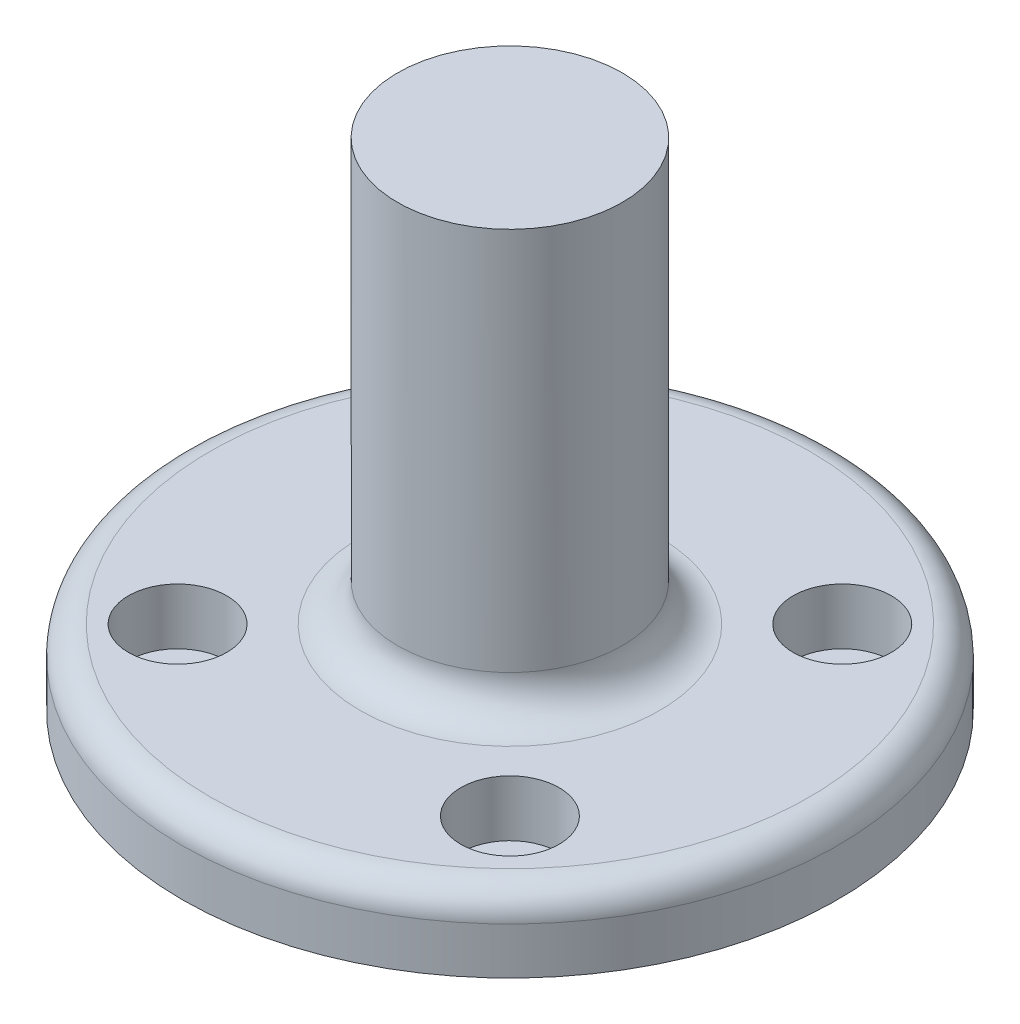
SolidWorks part; units mm, degrees
ref_plane "Front Plane" through (0, 0, 0) normal (0, 0, 1) x (1, 0, 0)
ref_plane "Top Plane" through (0, 0, 0) normal (0, 1, 0) x (1, 0, 0)
ref_plane "Right Plane" through (0, 0, 0) normal (1, 0, 0) x (0, 0, -1)
sketch "Sketch1" plane through (0, 0, 0) normal (0, 1, 0) x (1, 0, 0)
  circle A0 centre (0, 0) radius 35
  dimension "D1" = 70
extrude "Boss-Extrude1" add sketch "Sketch1" along normal blind 8
sketch "Sketch2" plane through (0, 8, 0) normal (0, 1, 0) x (1, 0, 0)
  circle A0 centre (-17.75, 17.75) radius 5.25
  circle A1 centre (17.75, 17.75) radius 5.25
  circle A2 centre (17.75, -17.75) radius 5.25
  circle A3 centre (-17.75, -17.75) radius 5.25
extrude "Cut-Extrude1" cut sketch "Sketch2" against normal blind 6
sketch "Sketch3" plane through (0, 2, 0) normal (0, 1, 0) x (1, 0, 0)
  circle A0 centre (17.75, 17.75) radius 3.25
  circle A1 centre (-17.75, 17.75) radius 3.25
  circle A2 centre (-17.75, -17.75) radius 3.25
  circle A3 centre (17.75, -17.75) radius 3.25
  dimension "D1" = 6.5
extrude "Cut-Extrude2" cut sketch "Sketch3" against normal blind 2
sketch "Sketch4" plane through (0, 0, 0) normal (0, 0, 1) x (1, 0, 0)
  line L0 (0, 43) -> (0, 53)
  line L1 (35, 8) -> (-35, 8) construction
  line L2 (0, 43) -> (0, 8)
  line L3 (12, 8) -> (0, 8)
  line L4 (12, 53) -> (0, 53)
  line L5 (12, 8) -> (12, 53)
  dimension "D1" = 12
  dimension "D3" = 45
revolve "Revolve1" add sketch "Sketch4" angle 360 about L0
fillet "Fillet1" radius 4 1 edges at (0, 8, 12)
fillet "Fillet3" radius 3 1 edges at (0, 8, 35)
equation "\"D5@Sketch2\"=\"D4@Sketch2\"/2"
equation "\"D3@Sketch2\"=\"D2@Sketch2\"/2"
equation "\"D9@Sketch2\"=\"D8@Sketch2\"/2"
equation "\"D7@Sketch2\"=\"D6@Sketch2\"/2"
